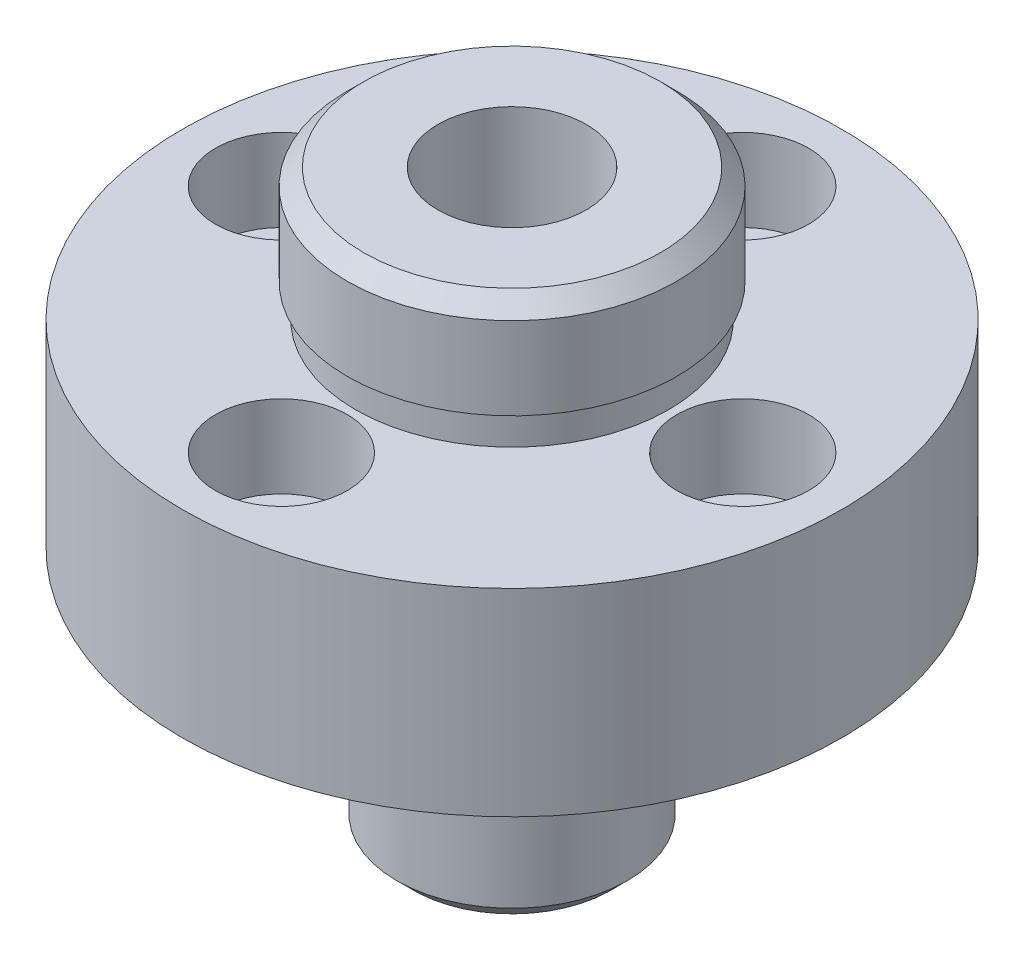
SolidWorks part; units mm, degrees
ref_plane "Plan de face" through (0, 0, 0) normal (0, 0, 1) x (1, 0, 0)
ref_plane "Plan de dessus" through (0, 0, 0) normal (0, 1, 0) x (1, 0, 0)
ref_plane "Plan de droite" through (0, 0, 0) normal (1, 0, 0) x (0, 0, -1)
sketch "Esquisse1" plane through (0, 0, 0) normal (0, 0, 1) x (1, 0, 0)
  line L0 (0, 0) -> (-7, 0)
  line L1 (-7, 0) -> (-7, 13)
  line L2 (-20, 15) -> (-6.5, 15)
  line L3 (-20, 15) -> (-20, 27)
  line L4 (-20, 27) -> (-9.5, 27)
  line L5 (-9.5, 27) -> (-9.5, 29)
  line L6 (-9.5, 29) -> (-10, 29)
  line L7 (-10, 29) -> (-10, 35)
  line L8 (-10, 35) -> (0, 35)
  line L9 (0, 35) -> (0, 0)
  line L10 (-7, 13) -> (-6.5, 13)
  line L11 (-6.5, 13) -> (-6.5, 15)
  dimension "D1" = 9.5
  dimension "D2" = 10
  dimension "D3" = 20
  dimension "D4" = 2
  dimension "D5" = 2
  dimension "D6" = 15
  dimension "D7" = 12
  dimension "D8" = 6
  dimension "D9" = 7
  dimension "D10" = 0.5
revolve "Révolution1" add sketch "Esquisse1" angle 360 about L9
chamfer "Chanfrein1" distance 1 angle 45 2 edges at (0, 0, 7) (0, 35, 10)
hole_wizard "Chambrage pour vis à tête hexagonale M41" positions "Esquisse3D1" profile "Esquisse2" counterbore size "M4" standard "ISO"
sketch3d "Esquisse3D1"
  line L0 (0, 13, 0) -> (0, 15, 0) construction
  line L1 (0, 1, 0) -> (0, 13, 0) construction
  line L2 (0, 29, 0) -> (0, 34, 0) construction
  point P0 (-14, 27, 0)
  point P2 (0, 27, -14)
  point P4 (14, 27, 0)
  point P6 (0, 27, 14)
  dimension "D1" = 14
  dimension "D2" = 14
  dimension "D3" = 14
  dimension "D4" = 14
sketch "Esquisse2" plane through (-14, 27, 0) normal (1, 0, 0) x (0, 0, 1)
  line L0 (0, 0) -> (0, 27)
  line L1 (0, 27) -> (2.25, 27)
  line L3 (2.25, 27) -> (2.25, 5)
  line L4 (2.25, 5) -> (4, 5)
  line L5 (4, 5) -> (4, 0)
  line L7 (4, 0) -> (0, 0)
  line L11 (0, -6.35) -> (0, 107.95) construction
  dimension "Diamètre du perçage jusqu'au prochain" = 4.5
  dimension "Profondeur du perçage jusqu'au prochain" = 27
  dimension "Diamètre du chambrage" = 8
  dimension "Profondeur du chambrage" = 5
hole_wizard "Trou taraudé M10x1.01" positions "Esquisse3D2" profile "Esquisse3" tap size "M10x1.0" standard "ISO"
sketch3d "Esquisse3D2"
  circle A0 centre (0, 35, 0) radius 9 construction
  point P0 (0, 35, 0)
  point P7 (0, 44, 0)
sketch "Esquisse3" plane through (0, 35, 0) normal (1, 0, 0) x (0, 0, 1)
  line L0 (0, 0) -> (0, 35)
  line L1 (0, 35) -> (4.5, 35)
  line L2 (4.5, 35) -> (4.5, 0)
  line L5 (4.5, 0) -> (0, 0)
  line L11 (0, -6.35) -> (0, 107.95) construction
  dimension "Diamètre du trou pour taraudage jusqu'au prochain" = 9
  dimension "Profondeur du trou pour taraudage jusqu'au prochain" = 35
